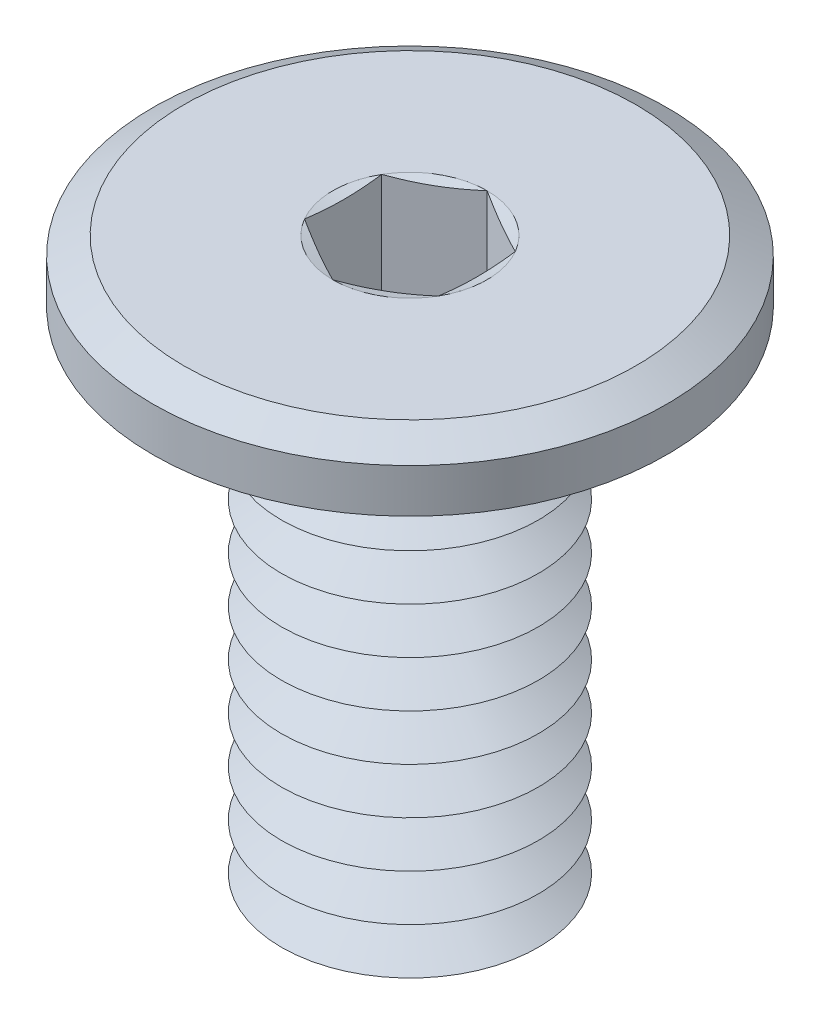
SolidWorks part; units mm, degrees
ref_plane "Front Plane" through (0, 0, 0) normal (0, 0, 1) x (1, 0, 0)
ref_plane "Top Plane" through (0, 0, 0) normal (0, 1, 0) x (1, 0, 0)
ref_plane "Right Plane" through (0, 0, 0) normal (1, 0, 0) x (0, 0, -1)
sketch "Sketch1" plane through (0, 0, 0) normal (0, 1, 0) x (1, 0, 0)
  circle A0 centre (0, 0) radius 2.5
  dimension "D1" = 5
extrude "Boss-Extrude1" add sketch "Sketch1" against normal blind 0.6
sketch "Sketch2" plane through (0, -0.6, 0) normal (0, -1, 0) x (1, 0, 0)
  circle A0 centre (0, 0) radius 1.25
  dimension "D1" = 2.5
extrude "Boss-Extrude2" add sketch "Sketch2" along normal blind 5
sketch "Sketch3" plane through (0, 0, 0) normal (1, 0, 0) x (0, 0, -1)
  line L0 (0, 0.9906) -> (0, -8.2999) construction
sketch "Sketch5" plane through (0, 0, 0) normal (1, 0, 0) x (0, 0, -1)
  line L0 (-1.25, -5.825) -> (-0.8603, -5.6)
  line L1 (-1.25, -0.6) -> (-1.25, -5.6) construction
  line L2 (-0.8603, -5.6) -> (-1.25, -5.375)
  line L3 (-1.25, -0.6) -> (-1.25, -5.6) construction
  line L4 (-1.25, -5.375) -> (-1.25, -5.825)
  line L6 (-1.25, -0.6) -> (-1.25, -5.6) construction
  line L7 (-1.25, -0.6) -> (-1.25, -5.6) construction
  line L14 (-1.25, -5.6) -> (1.25, -5.6) construction
  dimension "D1" = 0.45
revolve "Cut-Revolve1" cut sketch "Sketch5" angle 360 about L0
pattern_linear "LPattern1" count 10 spacing 0.45 along (0, 1, 0) of "Cut-Revolve1"
fillet "Fillet1" radius 0.1 1 edges at (0, -0.6, -1.25)
chamfer "Chamfer2" distance 0.3 angle 30 1 edges at (0, 0, 2.5)
sketch "Sketch6" plane through (0, 0, 0) normal (0, 1, 0) x (1, 0, 0)
  line L1 (0, 0.7506) -> (-0.65, 0.3753)
  line L2 (-0.65, 0.3753) -> (-0.65, -0.3753)
  line L3 (-0.65, -0.3753) -> (0, -0.7506)
  line L4 (0, -0.7506) -> (0.65, -0.3753)
  line L5 (0.65, -0.3753) -> (0.65, 0.3753)
  line L6 (0.65, 0.3753) -> (0, 0.7506)
  circle A0 centre (0, 0) radius 0.65 construction
  dimension "D1" = 1.3
extrude "Cut-Extrude1" cut sketch "Sketch6" against normal blind 1.2
sketch "Sketch7" plane through (0, -1.2, 0) normal (0, 1, 0) x (1, 0, 0)
  line L0 (-0.65, 0.3753) -> (-0.65, -0.3753) construction
  circle A0 centre (0, 0) radius 0.65
extrude "Cut-Extrude2" cut sketch "Sketch7" against normal through all draft 60
sketch "Sketch8" plane through (0, 0, 0) normal (0, 1, 0) x (1, 0, 0)
  circle A0 centre (0, 0) radius 0.7506
extrude "Cut-Extrude3" cut sketch "Sketch8" against normal through all draft 75
